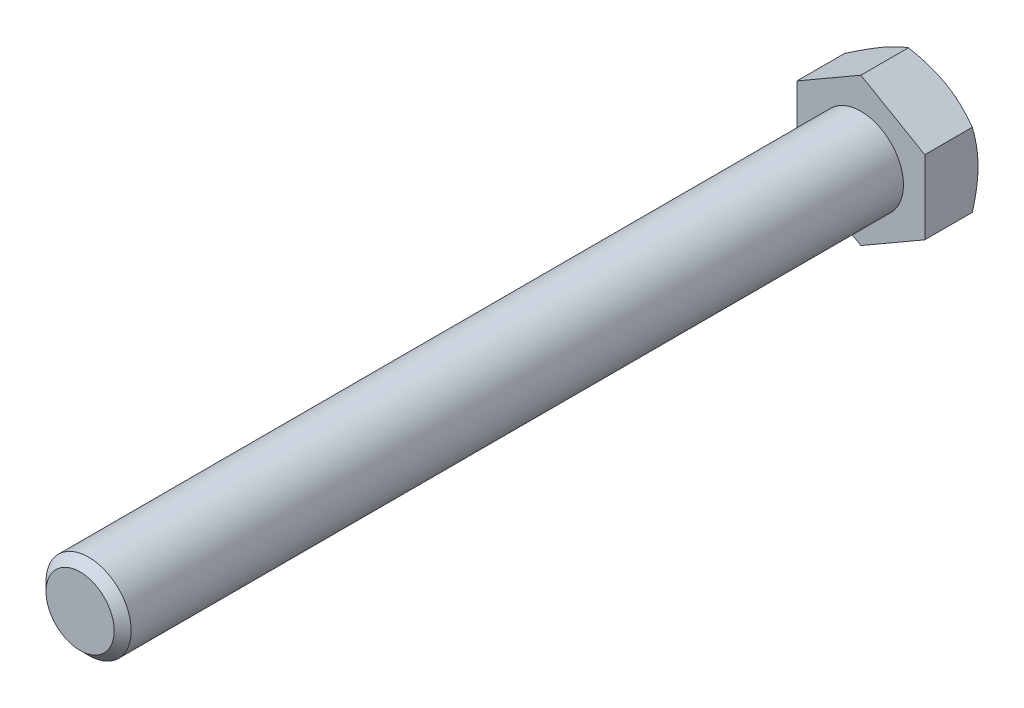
SolidWorks part; units mm, degrees
ref_plane "Plan1" through (0, 0, 0) normal (0, 0, 1) x (1, 0, 0)
ref_plane "Plan2" through (0, 0, 0) normal (0, 1, 0) x (1, 0, 0)
ref_plane "Plan3" through (0, 0, 0) normal (1, 0, 0) x (0, 0, -1)
sketch "Esquisse1" plane through (0, 0, 0) normal (0, 1, 0) x (1, 0, 0)
  line L1 (0, 0) -> (0, -110) construction
  line L2 (0, 0) -> (6, 0)
  line L3 (0, 0) -> (0, -110)
  line L4 (0, -110) -> (6, -110)
  line L6 (6, 0) -> (6, -110)
  dimension "D1" = 110
  dimension "D2" = 6
revolve "Base-Révolution" add sketch "Esquisse1" angle 360 about L1
chamfer "Chanfrein1" distance 1.2 angle 45 1 edges at (6, 0, 110)
sketch "Esquisse6" plane through (0, 0, 0) normal (0, 0, 1) x (1, 0, 0)
  line L0 (0, 0) -> (9, 0) construction
  line L1 (9, -5.1962) -> (9, 5.1962)
  line L2 (0, 0) -> (9, 5.1962) construction
  line L3 (0, 10.3923) -> (9, 5.1962)
  line L4 (0, -10.3923) -> (9, -5.1962)
  line L5 (0, 0) -> (0, 9) construction
  line L6 (-9, -5.1962) -> (-9, 5.1962)
  line L7 (-9, 5.1962) -> (0, 10.3923)
  line L8 (0, -10.3923) -> (-9, -5.1962)
  circle A0 centre (0, 0) radius 9 construction
  dimension "D2" = 30
  dimension "D1" = 18
extrude "Boss.-Extru.1" add sketch "Esquisse6" against normal blind 7.5
sketch "Esquisse7" plane through (0, 0, 0) normal (0, 1, 0) x (1, 0, 0)
  line L0 (-9, 7.5) -> (-21.9904, 7.5)
  line L1 (-9, 7.5) -> (-21.9904, 0)
  line L2 (-21.9904, 7.5) -> (-21.9904, 0)
  line L3 (0, 6.2394) -> (0, 0) construction
  line L4 (0, -108.8) -> (0, -110) construction
  dimension "D1" = 30
revolve "Enlèvement de matière-Révolution1" cut sketch "Esquisse7" angle 360 about L3
equation "\"D1@Chanfrein1\"=\"D2@Esquisse1\"*0.2"
equation "\"D2@Représentation de filetage1\"=\"D2@Esquisse1\"*1.6"
